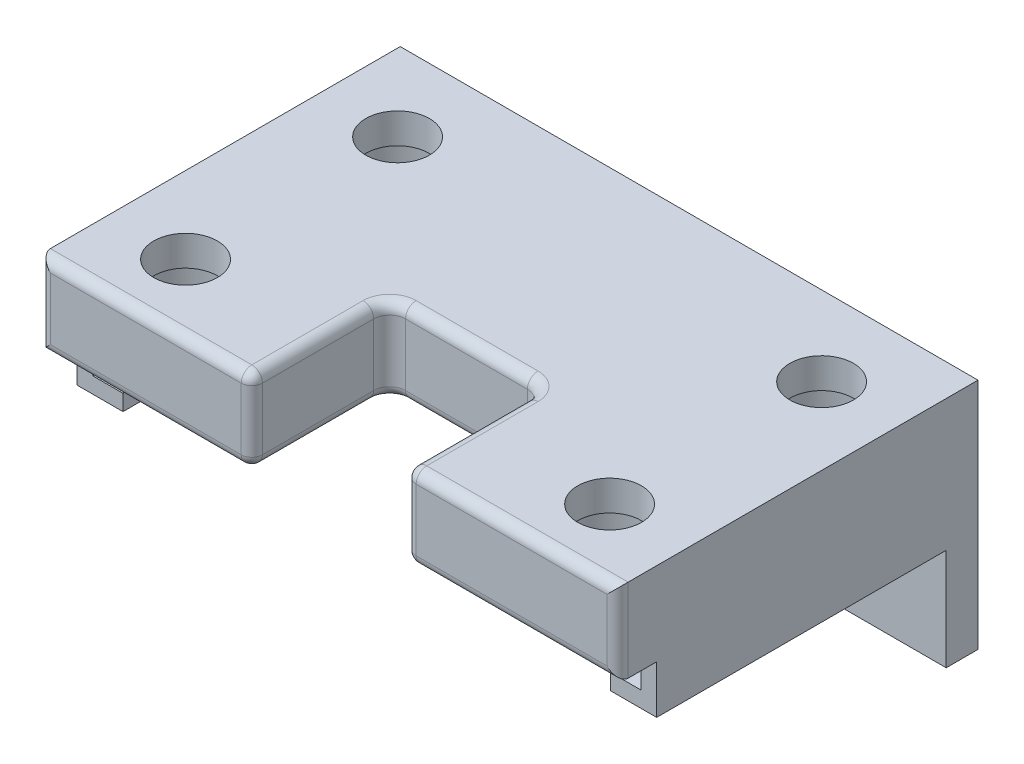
SolidWorks part; units mm, degrees
ref_plane "Alzado" through (0, 0, 0) normal (0, 0, 1) x (1, 0, 0)
ref_plane "Planta" through (0, 0, 0) normal (0, 1, 0) x (1, 0, 0)
ref_plane "Vista lateral" through (0, 0, 0) normal (1, 0, 0) x (0, 0, -1)
ref_plane "Plano1" through (0, 3.05, 0) normal (0, -1, 0) x (1, 0, 0)
sketch "Croquis1" plane through (0, 3.05, 0) normal (0, -1, 0) x (1, 0, 0)
  line L0 (50.15, 25.5) -> (-4.35, 25.5)
  line L1 (-4.35, 25.5) -> (-4.35, -5)
  line L2 (-4.35, -5) -> (50.15, -5)
  line L3 (50.15, -5) -> (50.15, 25.5)
extrude "Saliente-Extruir1" add sketch "Croquis1" against normal blind 7.85
ref_plane "Plano2" through (0, 0, 25.5) normal (0, 0, 1) x (1, 0, 0)
sketch "Croquis2" plane through (0, 0, 25.5) normal (0, 0, 1) x (1, 0, 0)
  line L0 (-4.35, 3.05) -> (-4.35, -1.5)
  line L1 (-4.35, -1.5) -> (0, -1.5)
  line L2 (0, -1.5) -> (0, 0)
  line L3 (0, 0) -> (-2.85, 0)
  line L4 (-2.85, 0) -> (-2.85, 3.05)
  line L5 (-2.85, 3.05) -> (-4.35, 3.05)
extrude "Saliente-Extruir2" add sketch "Croquis2" against normal up to surface (30.5 mm away)
sketch "Croquis3" plane through (0, 0, 25.5) normal (0, 0, 1) x (1, 0, 0)
  line L0 (50.15, 10.9) -> (50.15, 3.05)
  line L1 (50.15, 3.05) -> (-4.35, 3.05)
  line L2 (-4.35, 3.05) -> (-4.35, 10.9)
  line L3 (-4.35, 10.9) -> (50.15, 10.9)
extrude "Saliente-Extruir3" add sketch "Croquis3" along normal blind 4.5
sketch "Croquis4" plane through (0, 3.05, 0) normal (0, -1, 0) x (1, 0, 0)
  line L0 (48.65, 25.3094) -> (50.15, 25.3094)
  line L1 (50.15, 25.3094) -> (50.15, -5)
  line L2 (50.15, -5) -> (48.65, -5)
  line L3 (48.65, -5) -> (48.65, 25.3094)
  line L5 (-2.85, -5) -> (50.15, -5) construction
extrude "Saliente-Extruir4" add sketch "Croquis4" along normal blind 4.55
sketch "Croquis5" plane through (48.65, 0, 0) normal (-1, 0, 0) x (0, 0, 1)
  line L0 (25.3094, -1.5) -> (-5, -1.5)
  line L1 (-5, -1.5) -> (-5, 0)
  line L2 (-5, 0) -> (25.3094, 0)
  line L3 (25.3094, 0) -> (25.3094, -1.5)
  line L4 (-5, -1.5) -> (-5, 3.05) construction
  line L5 (25.3094, -1.5) -> (25.3094, 3.05) construction
extrude "Saliente-Extruir5" add sketch "Croquis5" along normal blind 2.85
sketch "Croquis6" plane through (0, 10.9, 0) normal (0, 1, 0) x (-1, 0, 0)
  line L1 (-30.15, 29) -> (-30.15, 16)
  line L2 (-30.15, 16) -> (-15.65, 16)
  line L3 (-15.65, 16) -> (-15.65, 29)
  line L4 (-50.15, -5) -> (-50.15, 30) construction
  line L5 (4.35, 30) -> (4.35, -5) construction
  line L6 (-15.65, 29) -> (4.35, 29)
  line L7 (-50.15, 30) -> (4.35, 30)
  line L8 (-50.15, 30) -> (-50.15, 29)
  line L9 (-50.15, 29) -> (-30.15, 29)
  line L10 (4.35, 30) -> (4.35, 29)
  dimension "D1" = 20
  dimension "D2" = 20
  dimension "D4" = 1
extrude "Cortar-Extruir1" cut sketch "Croquis6" against normal through all
hole_wizard "Taladro1" positions "Croquis8" profile "Croquis7" legacy
sketch "Croquis8" plane through (0, 3.05, 0) normal (0, -1, 0) x (-1, 0, 0)
  point P0 (-2.9, -2.5)
  point P1 (-42.9, -2.5)
  point P3 (-2.9, -22.5)
  point P4 (-42.9, -22.5)
  point P7 (0, 0)
sketch "Croquis7" plane through (2.9, 3.05, 2.5) normal (1, 0, 0) x (0, 0, -1)
  line L0 (0, 0) -> (0, 7.85)
  line L1 (0, 7.85) -> (3, 7.85)
  line L2 (3, 7.85) -> (3, 5)
  line L3 (3, 5) -> (4.5, 5)
  line L4 (4.5, 5) -> (4.5, 0)
  line L5 (4.5, 0) -> (0, 0)
  line L6 (0, 110) -> (0, -10) construction
  dimension "Diámetro" = 6
  dimension "Profundidad" = 7.85
  dimension "Diámetro de refrentado 1" = 9
  dimension "Profundidad de refrentado 1" = 5
fillet "Redondeo1" radius 1.5 2 edges at (15.65, 6.975, 16) (30.15, 6.975, 16)
sketch "Croquis11" plane through (0, 0, -5) normal (0, 0, -1) x (-1, 0, 0)
  line L0 (-50.15, 10.9) -> (4.35, 10.9)
  line L1 (-50.15, 10.9) -> (-50.15, -11.1)
  line L2 (4.35, 10.9) -> (4.35, -11.1)
  line L3 (-50.15, -11.1) -> (-32.9871, -11.1)
  line L4 (-12.8129, -11.1) -> (4.35, -11.1)
  arc A0 (-12.8129, -11.1) -> (-32.9871, -11.1) centre (-22.9, -17.6) ccw
  circle A1 centre (-38.4, -2.6) radius 1.75
  circle A2 centre (-7.4, -2.6) radius 1.75
  dimension "D2" = 24
  dimension "D5" = 3.5
  dimension "D6" = 3.5
  dimension "D1" = 22
  dimension "D3" = 6.5
  dimension "D4" = 27.25
  dimension "D7" = 11.75
  dimension "D8" = 11.75
  dimension "D9" = 8.5
  dimension "D10" = 8.5
extrude "Saliente-Extruir6" add sketch "Croquis11" against normal blind 3
chamfer "Chaflán2" distance 1 angle 45 2 edges at (36.65, -2.6, -5) (5.65, -2.6, -5)
fillet "Redondeo2" radius 1 18 edges at (30.15, 10.9, 23.25) (29.7107, 10.9, 16.4393) (22.9, 10.9, 16) (16.0893, 10.9, 16.4393) (15.65, 3.05, 23.25) (16.0893, 3.05, 16.4393) (22.9, 3.05, 16) (29.7107, 3.05, 16.4393) (-4.35, 6.975, 29) (5.65, 3.05, 29) (15.65, 6.975, 29) (5.65, 10.9, 29) (15.65, 10.9, 23.25) (30.15, 3.05, 23.25) (30.15, 6.975, 29) (40.15, 10.9, 29) (50.15, 6.975, 29) (40.15, 3.05, 29)
